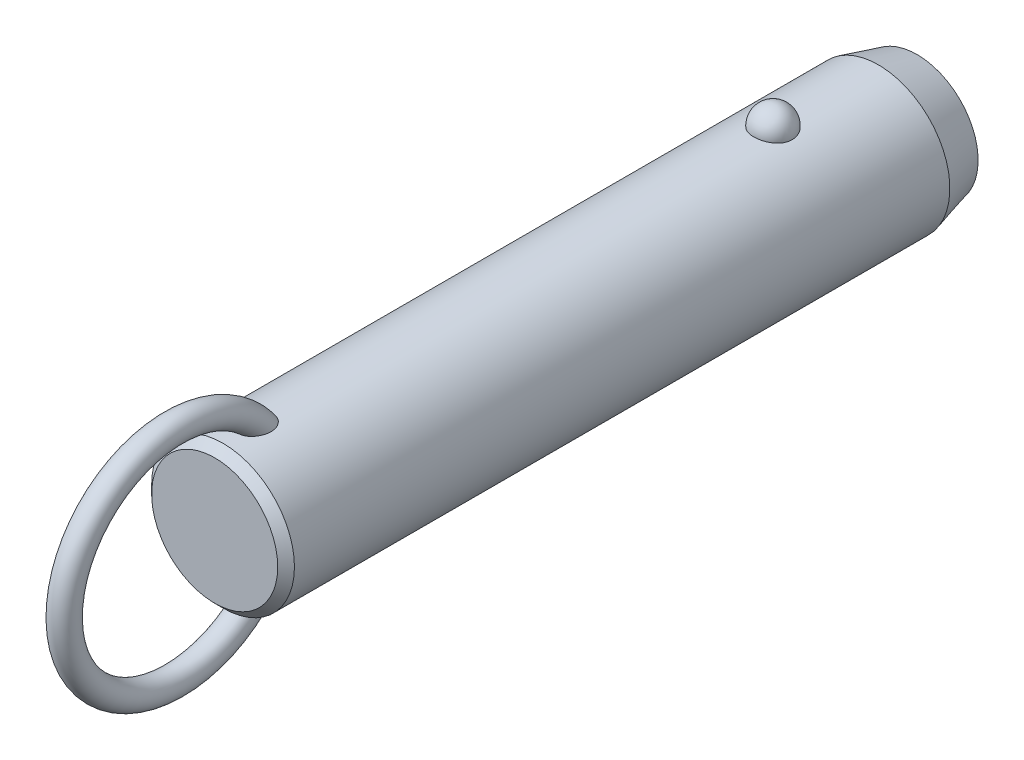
SolidWorks part; units mm, degrees
ref_plane "Front Plane" through (0, 0, 0) normal (0, 0, 1) x (1, 0, 0)
ref_plane "Top Plane" through (0, 0, 0) normal (0, 1, 0) x (1, 0, 0)
ref_plane "Right Plane" through (0, 0, 0) normal (1, 0, 0) x (0, 0, -1)
sketch "Sketch2" plane through (0, 0, 0) normal (0, 0, 1) x (1, 0, 0)
  circle A0 centre (0, 0) radius 11.1
  point P3 (0, 11.1)
  dimension "D1" = 22.2
extrude "Boss-Extrude1" add sketch "Sketch2" along normal blind 71.1
sketch "Sketch3" plane through (0, 0, 0) normal (0, 0, -1) x (-1, 0, 0)
  circle A0 centre (0, 0) radius 11.1
  dimension "D1" = 22.2
extrude "Boss-Extrude2" add sketch "Sketch3" along normal blind 25.4
chamfer "Chamfer1" distance 6 angle 15 1 edges at (-11.1, 0, -25.4)
sketch "Sketch12" plane through (0, 0, 0) normal (1, 0, 0) x (0, 0, -1)
  line L0 (-71.1, 11.1) -> (-71.1, -11.1) construction
  point P0 (-71.1, 0)
sketch "Sketch13" plane through (0, 0, 0) normal (1, 0, 0) x (0, 0, -1)
  circle A0 centre (-90.15, 0) radius 19.05
  point P2 (-71.1, 0)
  dimension "D1" = 38.1
sketch "Sketch14" plane through (0, 0, 0) normal (0, 1, 0) x (1, 0, 0)
  circle A0 centre (0, -73.1) radius 2
  point P2 (0, -71.1)
  dimension "D1" = 4
sweep "Sweep1" add profiles "Sketch14" path "Sketch13"
sketch "Sketch15" plane through (0, 0, 71.1) normal (0, 0, 1) x (1, 0, 0)
  circle A0 centre (0, 0) radius 11.1
  dimension "D1" = 22.2
extrude "Boss-Extrude3" add sketch "Sketch15" along normal blind 12.7
chamfer "Chamfer2" distance 1.3 angle 45 1 edges at (11.1, 0, 83.8)
sketch "Sketch18" plane through (0, 0, 0) normal (1, 0, 0) x (0, 0, -1)
  line L0 (19.4, 11.1) -> (-74.668, 11.1) construction
  line L1 (3, 14.1) -> (3, 8.1)
  line L2 (-74.668, -11.1) -> (19.4, -11.1) construction
  arc A0 (3, 14.1) -> (3, 8.1) centre (3, 11.1) ccw
  point P4 (0, 11.1)
  dimension "D1" = 25.2
revolve "Revolve1" add sketch "Sketch18" angle 360 about L1
